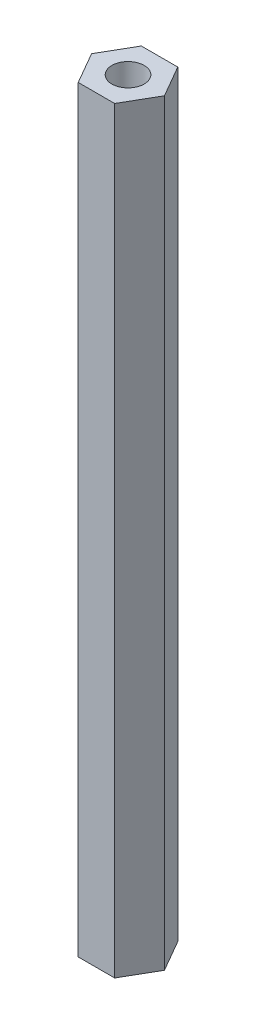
SolidWorks part; units mm, degrees
ref_plane "Front Plane" through (0, 0, 0) normal (0, 0, 1) x (1, 0, 0)
ref_plane "Top Plane" through (0, 0, 0) normal (0, 1, 0) x (1, 0, 0)
ref_plane "Right Plane" through (0, 0, 0) normal (1, 0, 0) x (0, 0, -1)
sketch "Sketch1" plane through (0, 0, 0) normal (0, 1, 0) x (1, 0, 0)
  line L1 (1.8331, 3.175) -> (-1.8331, 3.175)
  line L2 (-1.8331, 3.175) -> (-3.6662, 0)
  line L3 (-3.6662, 0) -> (-1.8331, -3.175)
  line L4 (-1.8331, -3.175) -> (1.8331, -3.175)
  line L5 (1.8331, -3.175) -> (3.6662, 0)
  line L6 (3.6662, 0) -> (1.8331, 3.175)
  circle A0 centre (0, 0) radius 3.175 construction
  circle A1 centre (0, 0) radius 1.6256
  dimension "D2" = 3.2512
  dimension "D1" = 6.35
extrude "Boss-Extrude1" add sketch "Sketch1" along normal blind 76.2
